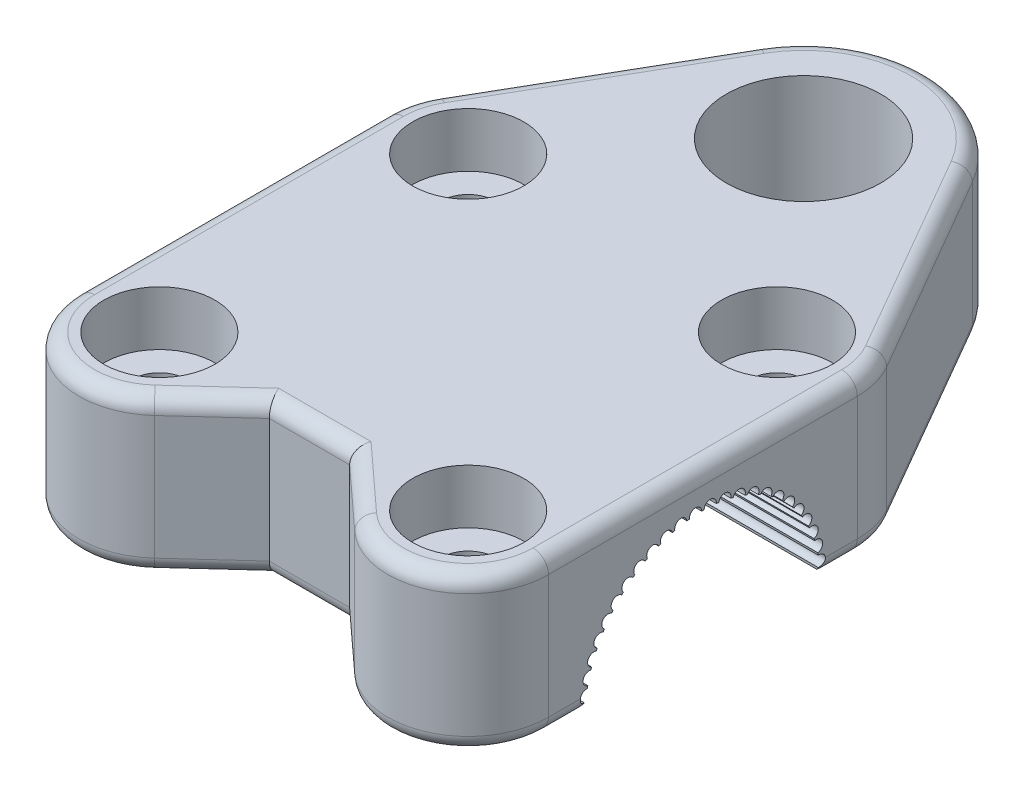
SolidWorks part; units mm, degrees
ref_plane "Front Plane" through (0, 0, 0) normal (0, 0, 1) x (1, 0, 0)
ref_plane "Top Plane" through (0, 0, 0) normal (0, 1, 0) x (1, 0, 0)
ref_plane "Right Plane" through (0, 0, 0) normal (1, 0, 0) x (0, 0, -1)
sketch "Sketch1" plane through (0, 0, 0) normal (0, 1, 0) x (1, 0, 0)
  line L0 (-6.5, 0) -> (6.5, 0)
  line L1 (-55, 0) -> (55, 0) construction
  line L2 (6.5, 0) -> (16.2272, -8.8949)
  line L3 (38, 0.6987) -> (38, 50.6987)
  line L4 (36.2583, 57.1987) -> (17.3205, 90)
  line L5 (-17.3205, 90) -> (-36.2583, 57.1987)
  line L6 (-38, 50.6987) -> (-38, 0.6987)
  line L7 (-16.2272, -8.8949) -> (-6.5, 0)
  line L8 (0, -55) -> (0, 55) construction
  line L9 (25, 0.6987) -> (-25, 0.6987) construction
  arc A0 (16.2272, -8.8949) -> (38, 0.6987) centre (25, 0.6987) ccw
  arc A1 (17.3205, 90) -> (-17.3205, 90) centre (0, 80) ccw
  arc A2 (-38, 0.6987) -> (-16.2272, -8.8949) centre (-25, 0.6987) ccw
  arc A3 (38, 50.6987) -> (36.2583, 57.1987) centre (25, 50.6987) ccw
  arc A4 (-36.2583, 57.1987) -> (-38, 50.6987) centre (-25, 50.6987) ccw
  point P6 (0, 0)
  dimension "D3" = 13
  dimension "D4" = 13
  dimension "D5" = 20
  dimension "D9" = 13
  dimension "D1" = 13
  dimension "D2" = 50
  dimension "D6" = 30
  dimension "D7" = 80
  dimension "D8" = 25
  dimension "D10" = 50
  dimension "D11" = 50
extrude "Boss-Extrude1" add sketch "Sketch1" along normal blind 25 contours L4 A1 L5 A4 L6 A2 L7 L0 L2 A0 L3 A3
hole_wizard "CBORE for M8 Hex Head Bolt1" positions "3DSketch1" profile "Sketch2" counterbore size "M8" standard "ANSI Metric"
sketch3d "3DSketch1"
  arc A0 (-38, 0, -0.6987) -> (-16.2272, 0, 8.8949) centre (-25, 0, -0.6987) ccw construction
  point P4 (-25, 25, -0.6987)
  point P21 (-25, 13, -0.6987)
sketch "Sketch2" plane through (-25, 25, -0.6987) normal (1, 0, 0) x (0, 0, 1)
  line L0 (0, 0) -> (0, 25)
  line L1 (0, 25) -> (4.4, 25)
  line L3 (4.4, 25) -> (4.4, 8.8)
  line L4 (4.4, 8.8) -> (9, 8.8)
  line L5 (9, 8.8) -> (9, 0)
  line L7 (9, 0) -> (0, 0)
  line L11 (0, -6.35) -> (0, 107.95) construction
  dimension "Thru Hole Dia." = 8.8
  dimension "Thru Hole Depth" = 25
  dimension "C'Bore Dia." = 18
  dimension "C'Bore Depth" = 8.8
pattern_linear "LPattern1" count 2 spacing 50 along (0, 0, -1) count 2 spacing 50 along (1, 0, 0) of "CBORE for M8 Hex Head Bolt1"
sketch "Sketch3" plane through (0, 25, 0) normal (0, 1, 0) x (1, 0, 0)
  line L0 (0, -13.75) -> (0, 13.75) construction
  circle A0 centre (0, 80) radius 12.5
  arc A1 (17.3205, 90) -> (-17.3205, 90) centre (0, 80) ccw construction
  dimension "D1" = 25
extrude "Cut-Extrude1" cut sketch "Sketch3" against normal blind 25
sketch "Sketch4" plane through (38, 0, 0) normal (1, 0, 0) x (0, 0, -1)
  line L0 (41.8, 0) -> (-41.8, 0) construction
  line L1 (-12.3013, 25) -> (-12.3013, 0) construction
  circle A0 centre (25.6987, 0) radius 19
  dimension "D1" = 38
  dimension "D2" = 38
extrude "Cut-Extrude2" cut sketch "Sketch4" against normal through all contours A0
sketch "Sketch5" plane through (38, 0, 0) normal (1, 0, 0) x (0, 0, -1)
  line L0 (41.8, 0) -> (-41.8, 0) construction
  circle A0 centre (44.6987, 0) radius 1
  arc A1 (44.6987, 0) -> (6.6987, 0) centre (25.6987, 0) ccw construction
  dimension "D1" = 2
extrude "Cut-Extrude3" cut sketch "Sketch5" against normal through all
pattern_circular "CirPattern1" count 26 over 180 about axis through (0, 0, -25.6987) along (1, 0, 0) of "Cut-Extrude3"
fillet "Fillet1" radius 2.5 26 edges at (-38, 0, -3.1987) (-11.3636, 0, 4.4475) (11.3636, 0, 4.4475) (38, 0, -3.1987) (38, 0, -48.1987) (37.557, 0, -54.0634) (-38, 0, -48.1987) (-37.557, 0, -54.0634) (-26.7894, 0, -73.5994) (0, 0, -100) (11.3636, 25, 4.4475) (30.2418, 25, 11.1976) (-11.3636, 25, 4.4475) (-30.2418, 25, 11.1976) (-38, 25, -25.6987) (-37.557, 25, -54.0634) (-26.7894, 25, -73.5994) (0, 25, -100) (26.7894, 25, -73.5994) (37.557, 25, -54.0634) (0, 25, 0) (-30.2418, 0, 11.1976) (0, 0, 0) (30.2418, 0, 11.1976) (26.7894, 0, -73.5994) (38, 25, -25.6987)
